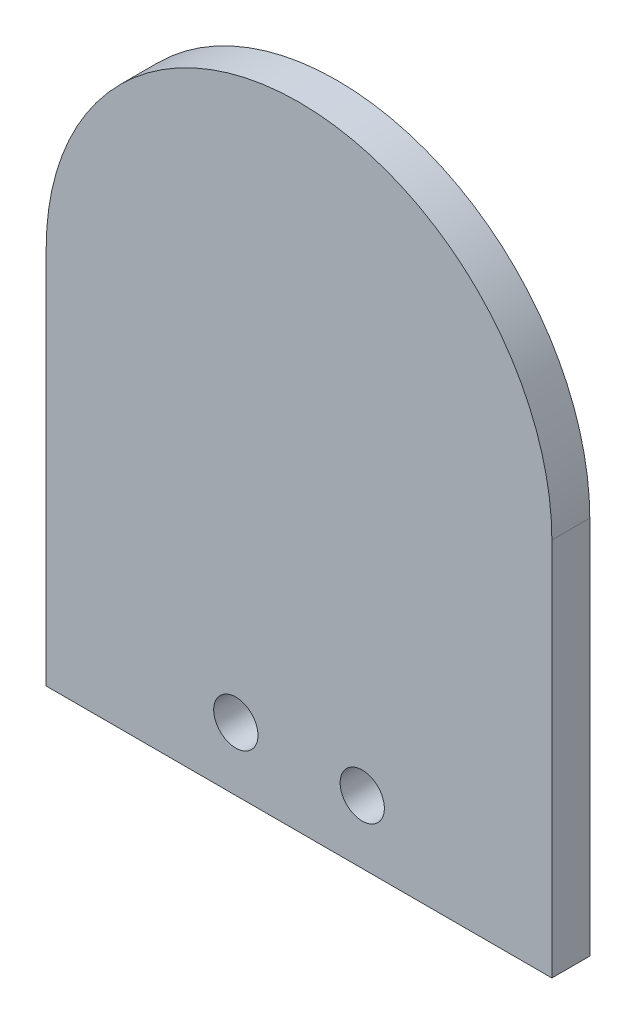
SolidWorks part; units mm, degrees
ref_plane "Front Plane" through (0, 0, 0) normal (0, 0, 1) x (1, 0, 0)
ref_plane "Top Plane" through (0, 0, 0) normal (0, 1, 0) x (1, 0, 0)
ref_plane "Right Plane" through (0, 0, 0) normal (1, 0, 0) x (0, 0, -1)
sketch "Sketch1" plane through (0, 0, 0) normal (0, 0, 1) x (1, 0, 0)
  line L0 (20, 0) -> (20, 72.426) construction
  line L1 (0, 0) -> (40, 0)
  line L2 (0, 0) -> (0, 30)
  line L4 (40, 0) -> (40, 30)
  arc A0 (40, 30) -> (0, 30) centre (20, 30) ccw
  circle A1 centre (15, 5) radius 1.75
  circle A2 centre (25, 5) radius 1.75
  dimension "D3" = 20
  dimension "D4" = 3.5
  dimension "D5" = 3.5
  dimension "D6" = 5
  dimension "D7" = 5
  dimension "D8" = 5
  dimension "D9" = 5
  dimension "D1" = 40
  dimension "D2" = 30
extrude "Extrude1" add sketch "Sketch1" along normal blind 3
